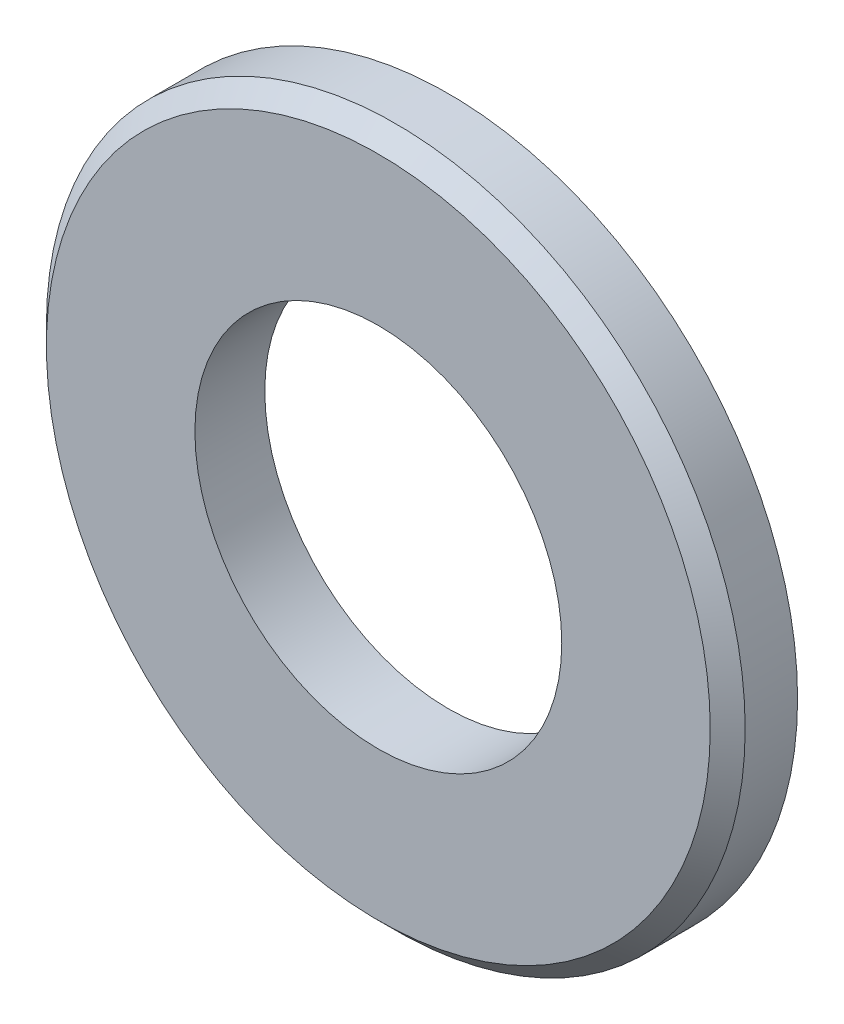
SolidWorks part; units mm, degrees
ref_plane "Front" through (0, 0, 0) normal (0, 0, 1) x (1, 0, 0)
ref_plane "Top" through (0, 0, 0) normal (0, 1, 0) x (1, 0, 0)
ref_plane "Right" through (0, 0, 0) normal (1, 0, 0) x (0, 0, -1)
other "Configuration Table"
sketch "Sketch1" plane through (0, 0, 0) normal (0, 0, 1) x (1, 0, 0)
  circle A0 centre (0, 0) radius 4.2
  circle A1 centre (0, 0) radius 8
  dimension "d1" = 8.4
  dimension "d2" = 16
extrude "Base-Extrude" add sketch "Sketch1" against normal blind 1.6
chamfer "Chamfer1" distance 0.4 angle 45 1 edges at (8, 0, 0)
equation "\"c@Chamfer1\"=\"h@Base-Extrude\" / 4"
